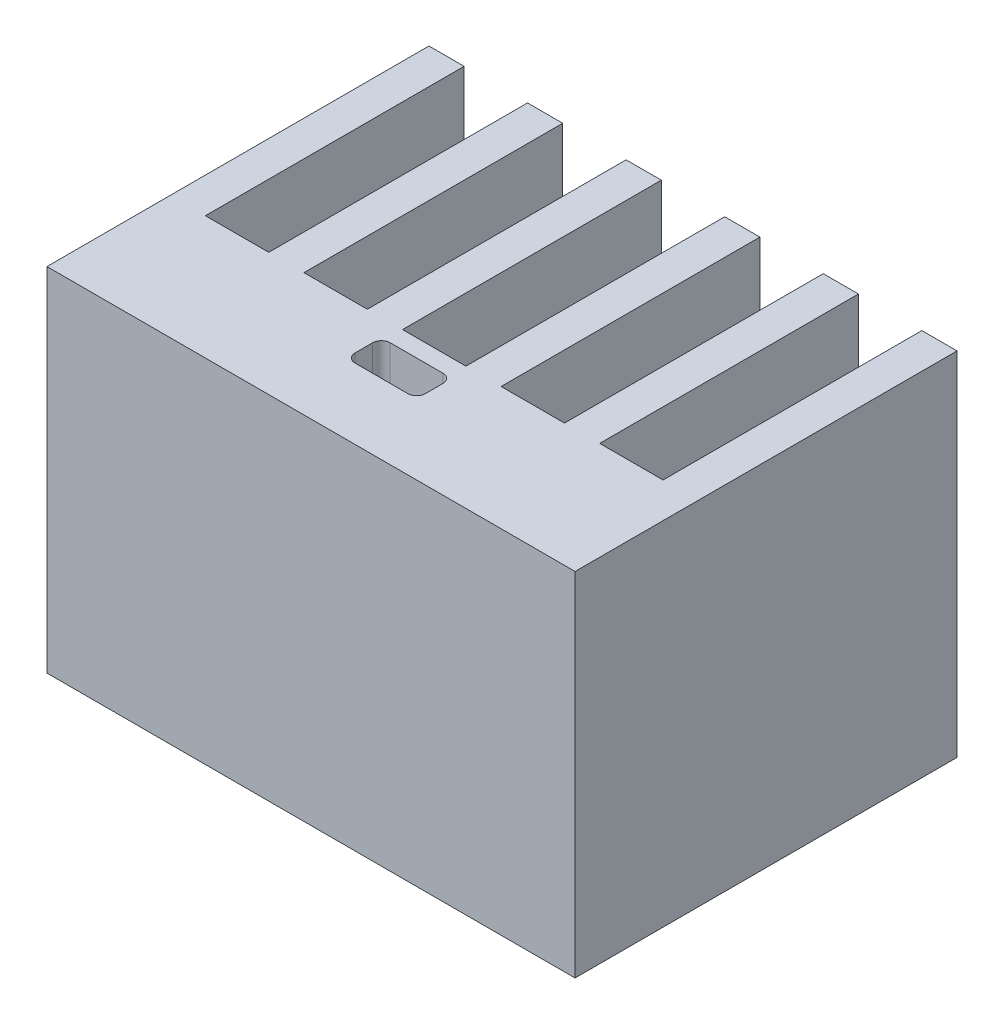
SolidWorks part; units mm, degrees
ref_plane "Спереди" through (0, 0, 0) normal (0, 0, 1) x (1, 0, 0)
ref_plane "Сверху" through (0, 0, 0) normal (0, 1, 0) x (1, 0, 0)
ref_plane "Справа" through (0, 0, 0) normal (1, 0, 0) x (0, 0, -1)
sketch "Эскиз1" plane through (0, 0, 0) normal (0, 0, 1) x (1, 0, 0)
  line L1 (15, -10) -> (-15, -10)
  line L2 (15, -10) -> (15, 10)
  line L3 (15, 10) -> (-15, 10)
  line L4 (-15, -10) -> (-15, 10)
  line L5 (15, -10) -> (-15, 10) construction
  line L6 (15, 10) -> (-15, -10) construction
  point P0 (0, 0)
  dimension "D1" = 20
  dimension "D2" = 30
extrude "Бобышка-Вытянуть1" add sketch "Эскиз1" along normal blind 7
sketch "Эскиз2" plane through (0, 0, 0) normal (0, 0, -1) x (-1, 0, 0)
  line L0 (15, -10) -> (-15, -10) construction
  line L1 (-15, 10) -> (-13, 10)
  line L2 (-15, 10) -> (-15, -10)
  line L3 (-15, -10) -> (-13, -10)
  line L4 (-13, 10) -> (-13, -10)
  line L5 (-9.4, 10) -> (-9.4, -10)
  line L6 (-9.4, 10) -> (-7.4, 10)
  line L7 (-7.4, 10) -> (-7.4, -10)
  line L8 (-9.4, -10) -> (-7.4, -10)
  line L9 (-3.8, 10) -> (-3.8, -10)
  line L10 (-3.8, 10) -> (-1.8, 10)
  line L11 (-1.8, 10) -> (-1.8, -10)
  line L12 (-3.8, -10) -> (-1.8, -10)
  line L13 (1.8, 10) -> (1.8, -10)
  line L14 (1.8, 10) -> (3.8, 10)
  line L15 (3.8, 10) -> (3.8, -10)
  line L16 (1.8, -10) -> (3.8, -10)
  line L17 (7.4, 10) -> (7.4, -10)
  line L18 (7.4, 10) -> (9.4, 10)
  line L19 (9.4, 10) -> (9.4, -10)
  line L20 (7.4, -10) -> (9.4, -10)
  line L21 (13, 10) -> (13, -10)
  line L22 (13, 10) -> (15, 10)
  line L23 (15, 10) -> (15, -10)
  line L24 (13, -10) -> (15, -10)
  dimension "D1" = 2
  dimension "D2" = 6
extrude "Бобышка-Вытянуть2" add sketch "Эскиз2" along normal blind 14.7
sketch "Эскиз3" plane through (0, 10, 0) normal (0, 1, 0) x (1, 0, 0)
  line L0 (15, -7) -> (15, 14.7) construction
  line L1 (-2, -1) -> (2, -1)
  line L2 (-2, -1) -> (-2, -3)
  line L3 (-2, -3) -> (2, -3)
  line L4 (2, -1) -> (2, -3)
  line L5 (1.8, 0) -> (-1.8, 0) construction
  dimension "D1" = 2
  dimension "D2" = 4
  dimension "D3" = 13
  dimension "D4" = 1
extrude "Вырез-Вытянуть1" cut sketch "Эскиз3" against normal blind 20
fillet "Скругление1" radius 0.5 4 edges at (-2, 0, 3) (-2, 0, 1) (2, 0, 3) (2, 0, 1)
